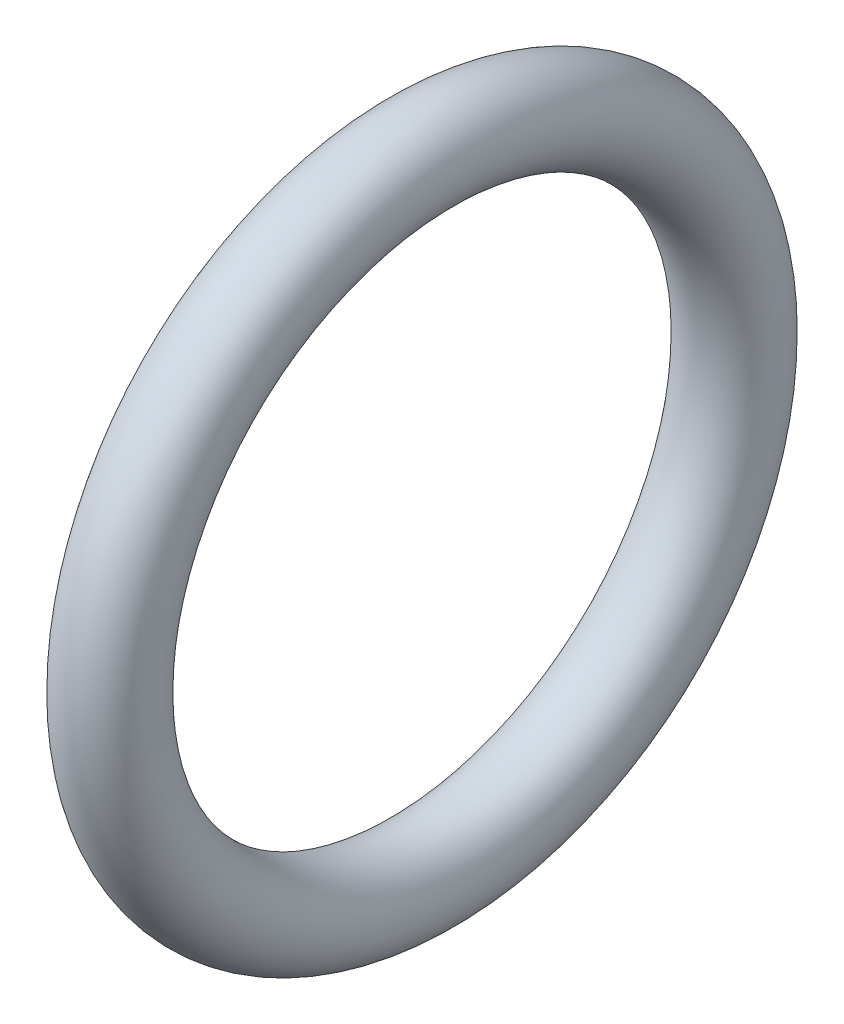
SolidWorks part; units mm, degrees
ref_plane "Plan1" through (0, 0, 0) normal (0, 0, 1) x (1, 0, 0)
ref_plane "Plan2" through (0, 0, 0) normal (0, 1, 0) x (1, 0, 0)
ref_plane "Plan3" through (0, 0, 0) normal (1, 0, 0) x (0, 0, -1)
sketch "Esquisse2" plane through (0, 0, 0) normal (0, 0, 1) x (1, 0, 0)
  line L0 (0, -9.1804) -> (0, 9.1804) construction
  line L1 (0, 0) -> (10, 0) construction
  circle A0 centre (0.5, 3.5) radius 0.5
  dimension "D1" = 1
  dimension "D2" = 7
revolve "Base-Révolution" add sketch "Esquisse2" angle 360 about L1
